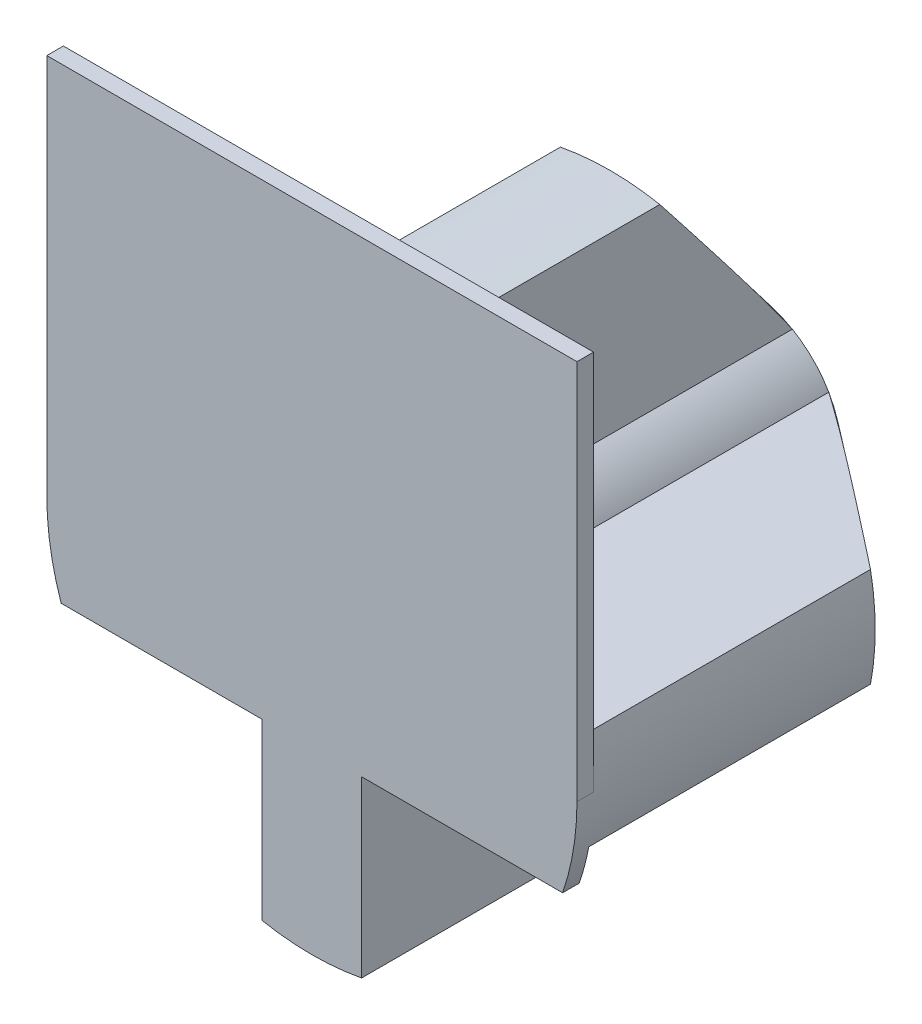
SolidWorks part; units mm, degrees
ref_plane "Ebene vorne" through (0, 0, 0) normal (0, 0, 1) x (1, 0, 0)
ref_plane "Ebene oben" through (0, 0, 0) normal (0, 1, 0) x (1, 0, 0)
ref_plane "Ebene rechts" through (0, 0, 0) normal (1, 0, 0) x (0, 0, -1)
sketch "Skizze4" plane through (0, 0, 0) normal (0, 0, 1) x (1, 0, 0)
  line L0 (0, 0) -> (0, 11) construction
  line L2 (1.5, 7.8581) -> (1.5, 2.5981)
  line L3 (-1.5, 7.8581) -> (-1.5, 2.5981)
  line L4 (7.8581, 1.5) -> (2.5981, 1.5)
  line L6 (7.8581, -1.5) -> (2.5981, -1.5)
  line L7 (1.5, -7.8581) -> (1.5, -2.5981)
  line L9 (-1.5, -7.8581) -> (-1.5, -2.5981)
  line L10 (-7.8581, -1.5) -> (-2.5981, -1.5)
  line L12 (-7.8581, 1.5) -> (-2.5981, 1.5)
  line L13 (0, 0) -> (5.7905, 0) construction
  arc A0 (-2.5981, -1.5) -> (-1.5, -2.5981) centre (0, 0) ccw
  arc A1 (-1.5, 2.5981) -> (-2.5981, 1.5) centre (0, 0) ccw
  arc A2 (2.5981, 1.5) -> (1.5, 2.5981) centre (0, 0) ccw
  arc A3 (1.5, -2.5981) -> (2.5981, -1.5) centre (0, 0) ccw
  arc A4 (-7.8581, 1.5) -> (-7.8581, -1.5) centre (0, 0) ccw
  arc A5 (-1.5, -7.8581) -> (1.5, -7.8581) centre (0, 0) ccw
  arc A6 (7.8581, -1.5) -> (7.8581, 1.5) centre (0, 0) ccw
  arc A7 (1.5, 7.8581) -> (-1.5, 7.8581) centre (0, 0) ccw
  point P23 (0, 0)
  dimension "D1" = 6
  dimension "D2" = 16
  dimension "D5" = 1.5
  dimension "D4" = 1.5
  dimension "D3" = 4
extrude "Aufsatz-Linear austragen2" add sketch "Skizze4" along normal blind 13
sketch "Skizze5" plane through (0, 0, 0) normal (1, 0, 0) x (0, 0, -1)
  line L1 (0, 2.5981) -> (0, 7.8581) construction
  line L5 (-4, 8) -> (0, 8)
  line L7 (0, 0) -> (-10.0303, 0) construction
  line L13 (-4, 8) -> (0, 3)
  line L14 (0, 8) -> (0, 3)
  dimension "D1" = 8
  dimension "D2" = 3
  dimension "D3" = 4
revolve "Schnitt-Rotation1" cut sketch "Skizze5" angle 360 about L7
sketch "Skizze6" plane through (0, 0, 0) normal (0, 0, -1) x (-1, 0, 0)
  line L0 (0, 0) -> (0, 2.5) construction
  line L1 (-0.8, 2.3685) -> (-0.8, 1.2)
  line L2 (-1.2, 0.8) -> (-2.3685, 0.8)
  line L3 (0.8, 1.2) -> (0.8, 2.3685)
  line L4 (2.3685, 0.8) -> (1.2, 0.8)
  line L5 (1.2, -0.8) -> (2.3685, -0.8)
  line L6 (0.8, -2.3685) -> (0.8, -1.2)
  line L7 (-0.8, -1.2) -> (-0.8, -2.3685)
  line L8 (-2.3685, -0.8) -> (-1.2, -0.8)
  arc A0 (-2.3685, 0.8) -> (-2.3685, -0.8) centre (0, 0) ccw
  arc A1 (-0.8, 1.2) -> (-1.2, 0.8) centre (-1.2, 1.2) cw
  arc A2 (1.2, 0.8) -> (0.8, 1.2) centre (1.2, 1.2) cw
  arc A3 (0.8, -1.2) -> (1.2, -0.8) centre (1.2, -1.2) cw
  arc A4 (-1.2, -0.8) -> (-0.8, -1.2) centre (-1.2, -1.2) cw
  arc A5 (0.8, 2.3685) -> (-0.8, 2.3685) centre (0, 0) ccw
  arc A6 (2.3685, -0.8) -> (2.3685, 0.8) centre (0, 0) ccw
  arc A7 (-0.8, -2.3685) -> (0.8, -2.3685) centre (0, 0) ccw
  point P27 (0, 0)
  dimension "D1" = 5
  dimension "D4" = 0.4
  dimension "D2" = 0.8
  dimension "D3" = 0.8
  dimension "D5" = 4
extrude "Schnitt-Linear austragen1" cut sketch "Skizze6" against normal blind 8
sketch "Skizze7" plane through (0, 0, 13) normal (0, 0, 1) x (1, 0, 0)
  line L0 (-7.5664, -2.5981) -> (7.5664, -2.5981)
  line L2 (8, 11.5) -> (8, 0)
  line L4 (-8, 11.5) -> (-8, 0)
  line L5 (8, 11.5) -> (-8, 11.5)
  arc A0 (7.5664, -2.5981) -> (8, 0) centre (0, 0) ccw
  arc A1 (-8, 0) -> (-7.5664, -2.5981) centre (0, 0) ccw
  dimension "D1" = 8
  dimension "D2" = 11.5
extrude "Aufsatz-Linear austragen3" add sketch "Skizze7" against normal blind 0.5
